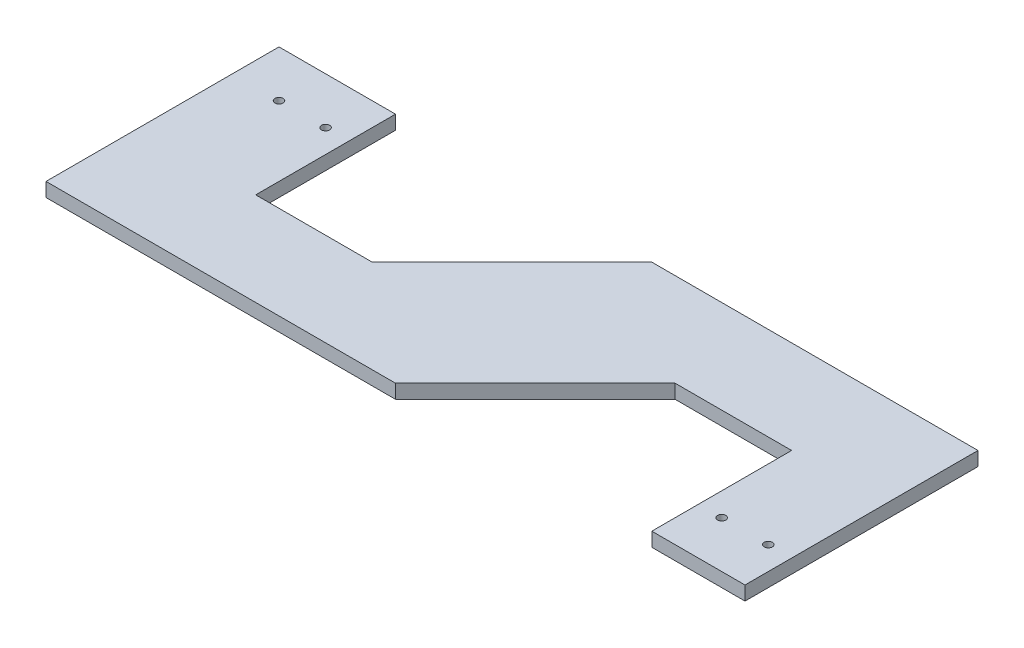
SolidWorks part; units mm, degrees
ref_plane "Front Plane" through (0, 0, 0) normal (0, 0, 1) x (1, 0, 0)
ref_plane "Top Plane" through (0, 0, 0) normal (0, 1, 0) x (1, 0, 0)
ref_plane "Right Plane" through (0, 0, 0) normal (1, 0, 0) x (0, 0, -1)
sketch "Sketch1" plane through (0, 0, 0) normal (0, 1, 0) x (1, 0, 0)
  line L0 (260, 0) -> (260, 60)
  line L1 (0, 0) -> (150, 0)
  line L2 (0, 0) -> (0, 100)
  line L3 (0, 100) -> (50, 100)
  line L4 (300, 0) -> (300, 100)
  line L5 (50, 100) -> (50, 40)
  line L6 (260, 60) -> (210, 60)
  line L7 (50, 40) -> (100, 40)
  line L8 (100, 40) -> (160, 100)
  line L9 (210, 60) -> (150, 0)
  line L10 (260, 0) -> (300, 0)
  line L11 (160, 100) -> (300, 100)
  circle A0 centre (20, 80) radius 1.75
  circle A1 centre (290, 20) radius 1.75
  circle A2 centre (40, 80) radius 1.75
  circle A3 centre (270, 20) radius 1.75
  dimension "D3" = 3.5
  dimension "D4" = 10
  dimension "D5" = 20
  dimension "D6" = 20
  dimension "D7" = 20
  dimension "D8" = 20
  dimension "D9" = 20
  dimension "D10" = 20
  dimension "D11" = 20
  dimension "D1" = 100
  dimension "D2" = 300
  dimension "D12" = 40
  dimension "D13" = 50
  dimension "D14" = 50
  dimension "D15" = 50
  dimension "D16" = 40
  dimension "D17" = 40
  dimension "D18" = 135
  dimension "D19" = 135
extrude "Extrude1" add sketch "Sketch1" along normal blind 6
sketch "Sketch2" plane through (0, 0, 0) normal (0, -1, 0) x (1, 0, 0)
  circle A0 centre (290, -20) radius 3.25
  circle A1 centre (270, -20) radius 3.25
  circle A2 centre (40, -80) radius 3.25
  circle A3 centre (20, -80) radius 3.25
  dimension "D1" = 6.5
extrude "Extrude2" cut sketch "Sketch2" against normal blind 3
